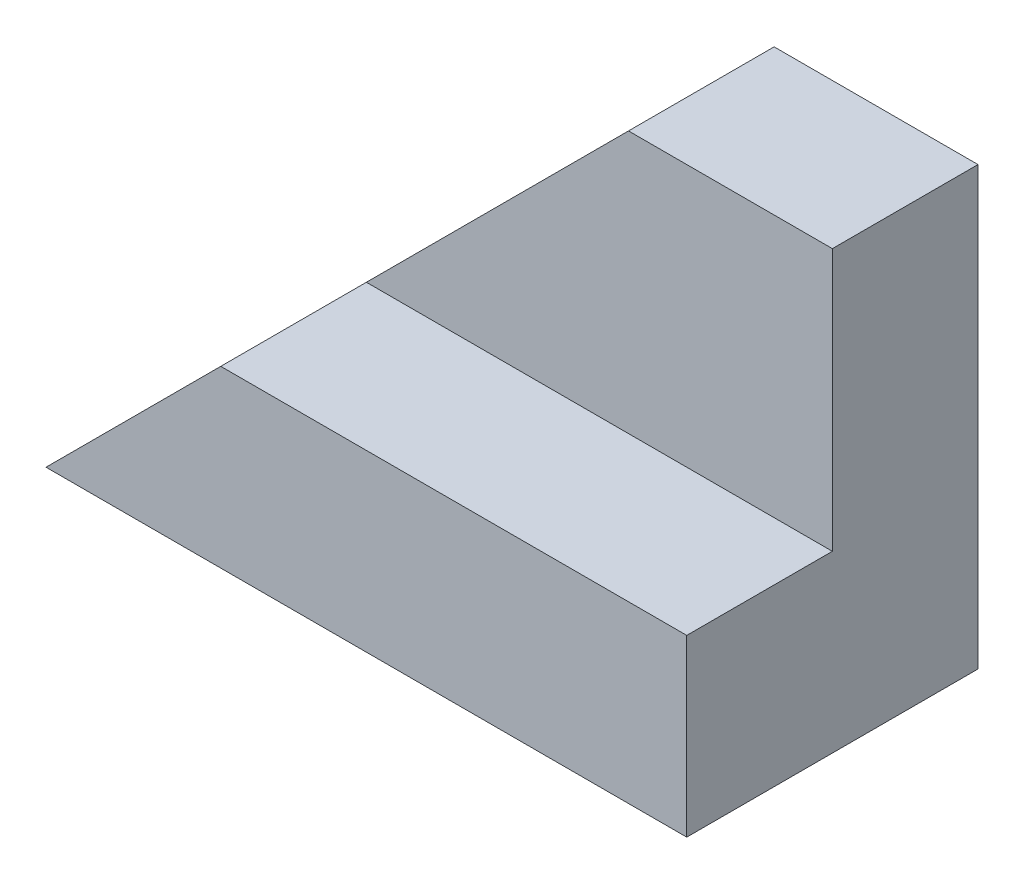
SolidWorks part; units mm, degrees
ref_plane "前视基准面" through (0, 0, 0) normal (0, 0, 1) x (1, 0, 0)
ref_plane "上视基准面" through (0, 0, 0) normal (0, 1, 0) x (1, 0, 0)
ref_plane "右视基准面" through (0, 0, 0) normal (1, 0, 0) x (0, 0, -1)
sketch "草图1" plane through (0, 0, 0) normal (0, 0, 1) x (1, 0, 0)
  line L0 (0, 0) -> (110, 0)
  line L1 (110, 0) -> (110, 75)
  line L2 (110, 75) -> (75, 75)
  line L3 (75, 75) -> (0, 0)
  dimension "D1" = 35
  dimension "D2" = 75
  dimension "D3" = 110
extrude "拉伸1" add sketch "草图1" along normal blind 50
sketch "草图2" plane through (0, 0, 50) normal (0, 0, 1) x (1, 0, 0)
  line L0 (75, 75) -> (110, 75)
  line L1 (110, 75) -> (110, 30)
  line L2 (110, 0) -> (110, 75) construction
  line L3 (110, 30) -> (30, 30)
  line L4 (75, 75) -> (0, 0) construction
  line L5 (30, 30) -> (75, 75)
  line L6 (0, 0) -> (110, 0) construction
  dimension "D1" = 30
extrude "切除-拉伸1" cut sketch "草图2" against normal blind 25
